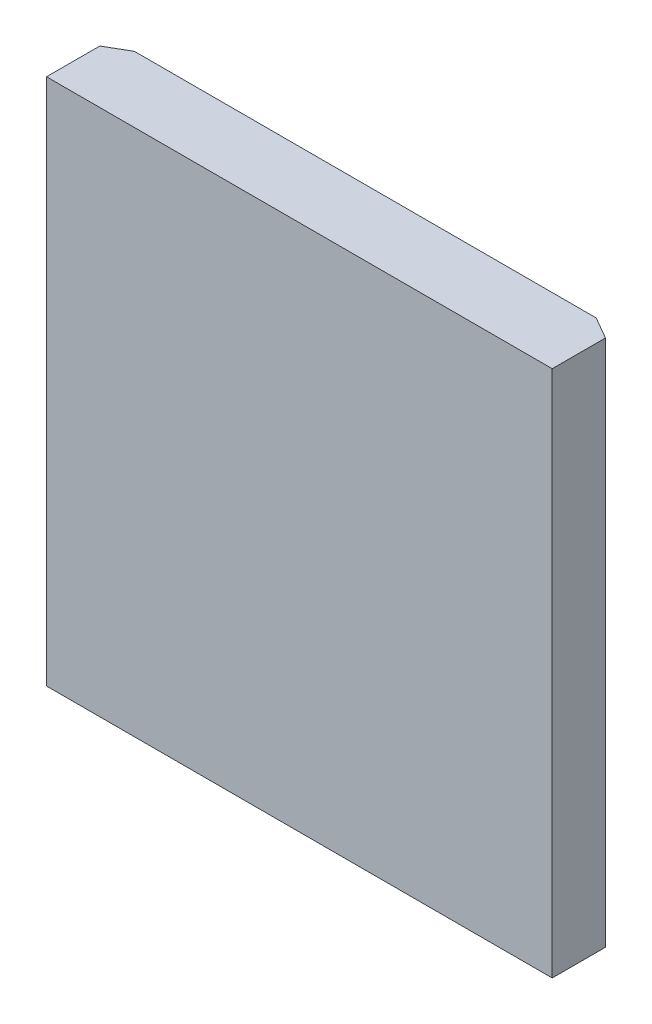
SolidWorks part; units mm, degrees
ref_plane "Front" through (0, 0, 0) normal (0, 0, 1) x (1, 0, 0)
ref_plane "Top" through (0, 0, 0) normal (0, 1, 0) x (1, 0, 0)
ref_plane "Right" through (0, 0, 0) normal (1, 0, 0) x (0, 0, -1)
sketch "Sketch1" plane through (0, 0, 0) normal (0, 1, 0) x (1, 0, 0)
  line L1 (-146.05, -19.05) -> (146.05, -19.05)
  line L2 (-146.05, -19.05) -> (-146.05, 19.05)
  line L3 (-146.05, 19.05) -> (146.05, 19.05)
  line L4 (146.05, -19.05) -> (146.05, 19.05)
  line L5 (-146.05, -19.05) -> (146.05, 19.05) construction
  line L6 (-146.05, 19.05) -> (146.05, -19.05) construction
  point P0 (0, 0)
  dimension "D1" = 38.1
  dimension "D2" = 292.1
extrude "Boss-Extrude1" add sketch "Sketch1" along normal mid plane 304.8
chamfer "Chamfer1" distance 12.7 angle 30 1 edges at (-146.05, 0, -19.05)
chamfer "Chamfer2" distance 12.7 angle 30 1 edges at (146.05, 0, -19.05)
